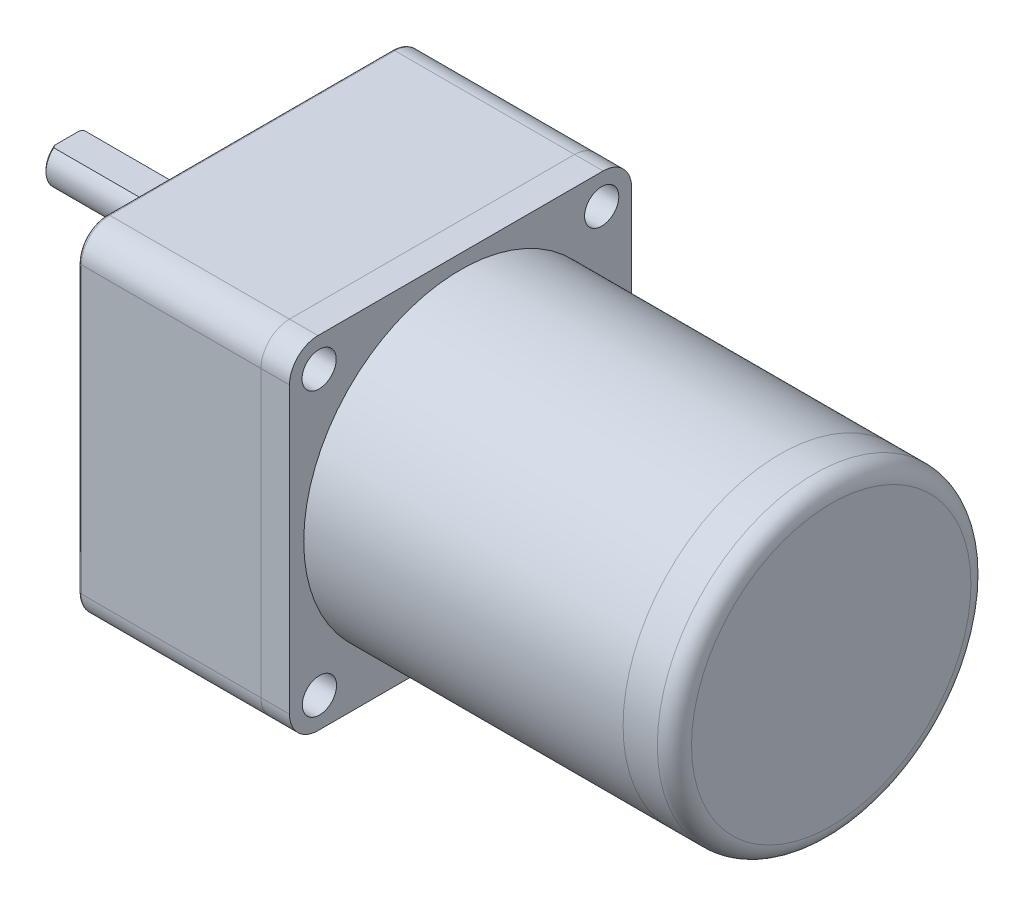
SolidWorks part; units mm, degrees
ref_plane "前视基准面" through (0, 0, 0) normal (0, 0, 1) x (1, 0, 0)
ref_plane "上视基准面" through (0, 0, 0) normal (0, 1, 0) x (1, 0, 0)
ref_plane "右视基准面" through (0, 0, 0) normal (1, 0, 0) x (0, 0, -1)
sketch "草图1" plane through (0, 0, 0) normal (1, 0, 0) x (0, 0, -1)
  line L1 (-25, -30) -> (25, -30)
  line L2 (-30, -25) -> (-30, 25)
  line L3 (-25, 30) -> (25, 30)
  line L4 (30, -25) -> (30, 25)
  line L5 (-30, -30) -> (30, 30) construction
  line L6 (-30, 30) -> (30, -30) construction
  arc A0 (-25, -30) -> (-30, -25) centre (-25, -25) cw
  arc A1 (25, -30) -> (30, -25) centre (25, -25) ccw
  arc A2 (25, 30) -> (30, 25) centre (25, 25) cw
  arc A3 (-30, 25) -> (-25, 30) centre (-25, 25) cw
  point P0 (0, 0)
  dimension "D1" = 5
extrude "凸台-拉伸1" add sketch "草图1" along normal blind 32
sketch "草图2" plane through (32, 0, 0) normal (1, 0, 0) x (0, 0, -1)
  line L0 (25, 30) -> (-25, 30) construction
  line L1 (-25, -30) -> (25, -30)
  line L2 (-30, -25) -> (-30, 25)
  line L3 (-25, 30) -> (25, 30)
  line L4 (30, -25) -> (30, 25)
  line L5 (-30, -30) -> (30, 30) construction
  line L6 (-30, 30) -> (30, -30) construction
  arc A0 (25, 30) -> (30, 25) centre (25, 25) cw
  arc A1 (25, -30) -> (30, -25) centre (25, -25) ccw
  arc A2 (-25, -30) -> (-30, -25) centre (-25, -25) cw
  arc A3 (-30, 25) -> (-25, 30) centre (-25, 25) cw
  point P0 (0, 0)
  dimension "D1" = 5
extrude "凸台-拉伸2" add sketch "草图2" along normal blind 5 separate body
sketch "草图3" plane through (37, 0, 0) normal (1, 0, 0) x (0, 0, -1)
  circle A0 centre (0, 0) radius 27.5
extrude "凸台-拉伸3" add sketch "草图3" along normal blind 56 separate body
sketch "草图4" plane through (93, 0, 0) normal (1, 0, 0) x (0, 0, -1)
  circle A0 centre (0, 0) radius 27.5
extrude "凸台-拉伸4" add sketch "草图4" along normal blind 9 separate body
fillet "圆角1" radius 3 1 edges at (102, 0, -27.5)
sketch "草图5" plane through (0, 0, 0) normal (-1, 0, 0) x (0, 0, 1)
  circle A0 centre (0, 10) radius 12
extrude "凸台-拉伸5" add sketch "草图5" along normal blind 3 separate body
sketch "草图6" plane through (-3, 0, 0) normal (-1, 0, 0) x (0, 0, 1)
  circle A0 centre (0, 10) radius 4
extrude "凸台-拉伸6" add sketch "草图6" along normal blind 29 separate body
fillet "圆角2" radius 0.5 1 edges at (-3, 10, 12)
sketch "草图7" plane through (-32, 0, 0) normal (-1, 0, 0) x (0, 0, 1)
  line L2 (2.6458, 13) -> (-2.6458, 13)
  arc A0 (2.6458, 13) -> (-2.6458, 13) centre (0, 10) ccw
extrude "切除-拉伸1" cut sketch "草图7" against normal blind 25
chamfer "倒角1" distance 0.3 angle 45 1 edges at (-32, 6, 0)
sketch "草图8" plane through (0, 0, 0) normal (-1, 0, 0) x (0, 0, 1)
  circle A0 centre (0, 0) radius 26.3
extrude "切除-拉伸2" cut sketch "草图8" against normal blind 0.5
fillet "圆角3" radius 0.5 1 edges at (0, 0, 26.3)
fillet "圆角4" radius 0.5 8 edges at (0, -30, 0) (0, -28.5355, -28.5355) (0, 0, -30) (0, 28.5355, -28.5355) (0, 30, 0) (0, 28.5355, 28.5355) (0, 0, 30) (0, -28.5355, 28.5355)
sketch "草图9" plane through (0, 0, 0) normal (-1, 0, 0) x (0, 0, 1)
  point P19 (-24.7487, 24.7487)
  point P20 (24.7487, 24.7487)
  point P21 (24.7487, -24.7487)
  point P22 (-24.7487, -24.7487)
hole_wizard "M4 螺纹孔1" positions "3D草图1" profile "草图10" tap size "M4" standard "GB"
sketch3d "3D草图1"
  point P0 (0, 24.7487, -24.7487)
  point P3 (0, 24.7487, 24.7487)
  point P6 (0, -24.7487, 24.7487)
  point P9 (0, -24.7487, -24.7487)
sketch "草图10" plane through (0, 24.7487, -24.7487) normal (0, 1, 0) x (0, 0, 1)
  line L0 (0, 0) -> (0, 12.9914)
  line L1 (0, 12.9914) -> (1.65, 12)
  line L2 (1.65, 12) -> (1.65, 0)
  line L5 (1.65, 0) -> (0, 0)
  line L10 (0, 12.9914) -> (-1.65, 12) construction
  line L11 (0, -6.35) -> (0, 107.95) construction
  dimension "螺纹孔钻头直径" = 3.3
  dimension "螺纹孔钻头深度" = 12
  dimension "导头角度" = 118
sketch "草图11" plane through (37, 0, 0) normal (1, 0, 0) x (0, 0, -1)
  circle A5 centre (-24.8007, 24.8007) radius 3
  circle A6 centre (24.7487, 24.7487) radius 3
  circle A7 centre (24.7487, -24.7487) radius 3
  circle A8 centre (-24.7487, -24.7487) radius 3
extrude "切除-拉伸3" cut sketch "草图11" against normal blind 25
